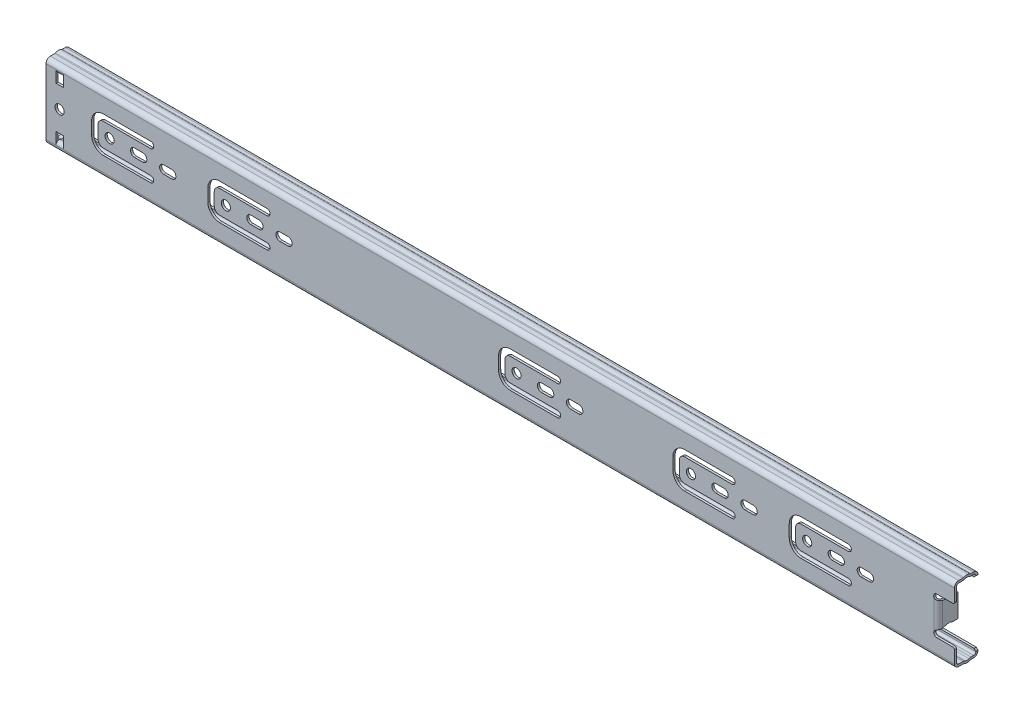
SolidWorks part; units mm, degrees
ref_plane "Front Plane" through (0, 0, 0) normal (0, 0, 1) x (1, 0, 0)
ref_plane "Top Plane" through (0, 0, 0) normal (0, 1, 0) x (1, 0, 0)
ref_plane "Right Plane" through (0, 0, 0) normal (1, 0, 0) x (0, 0, -1)
imported_body "Imported3"
sketch "Sketch1" plane through (237.9083, 0, 0) normal (-1, 0, 0) x (0, 0, 1)
  line L0 (-5.0493, 20.5) -> (0, 20.5)
  line L1 (0, 20.5) -> (0, -20.5)
  line L2 (0, -20.5) -> (-5.0493, -20.5)
  line L3 (-8.7641, -20.5) -> (-8.7641, -17.9939)
  line L4 (-8.7641, -17.9939) -> (-1.2, -17.9939)
  line L5 (-1.8294, -17.511) -> (-2.14, -16.3519)
  line L6 (-1.2, -16.3691) -> (-1.2, 16.3691)
  line L7 (-2.14, 16.3519) -> (-1.8294, 17.511)
  line L8 (-1.2, 17.9939) -> (-8.7641, 17.9939)
  line L9 (-8.7641, 17.9939) -> (-8.7641, 20.5)
  arc A0 (-8.7641, 20.5) -> (-5.0493, 20.5) centre (-6.9067, 17.3) cw
  arc A1 (-5.0493, -20.5) -> (-8.7641, -20.5) centre (-6.9067, -17.3) cw
  arc A2 (-1.2, -17.9939) -> (-1.8294, -17.511) centre (-1.7, -17.9939) ccw
  arc A3 (-2.14, -16.3519) -> (-1.2, -16.3691) centre (-1.7, -17.9939) cw
  arc A4 (-1.2, 16.3691) -> (-2.14, 16.3519) centre (-1.7, 17.9939) cw
  arc A5 (-1.8294, 17.511) -> (-1.2, 17.9939) centre (-1.7, 17.9939) ccw
extrude "Boss-Extrude1" add sketch "Sketch1" along normal blind 478.4083
sketch "Sketch2" plane through (237.9083, 0, 0) normal (1, 0, 0) x (0, 0, -1)
  line L0 (8.7641, 17.9939) -> (1.2, 17.9939)
  line L1 (1.8294, 17.511) -> (2.14, 16.3519)
  line L2 (1.2, 16.3691) -> (1.2, 10.4)
  line L3 (1.2, 10.4) -> (0, 10.4)
  line L4 (0, 10.4) -> (0, 20.5)
  line L5 (0, 20.5) -> (5.0493, 20.5)
  line L6 (8.7641, 20.5) -> (8.7641, 17.9939)
  arc A0 (1.2, 17.9939) -> (1.8294, 17.511) centre (1.7, 17.9939) ccw
  arc A1 (2.14, 16.3519) -> (1.2, 16.3691) centre (1.7, 17.9939) cw
  arc A2 (5.0493, 20.5) -> (8.7641, 20.5) centre (6.9067, 17.3) cw
extrude "Boss-Extrude2" add sketch "Sketch2" along normal blind 0.3762
sketch "Sketch3" plane through (-240.5, 0, 0) normal (-1, 0, 0) x (0, 0, 1)
  line L0 (-5.0493, 20.5) -> (0, 20.5)
  line L1 (0, 20.5) -> (0, -20.5)
  line L2 (0, -20.5) -> (-5.0493, -20.5)
  line L3 (-8.7641, -20.5) -> (-8.7641, -17.9939)
  line L4 (-8.7641, -17.9939) -> (-1.2, -17.9939)
  line L5 (-1.8294, -17.511) -> (-2.14, -16.3519)
  line L6 (-1.2, -16.3691) -> (-1.2, 16.3691)
  line L7 (-2.14, 16.3519) -> (-1.8294, 17.511)
  line L8 (-1.2, 17.9939) -> (-8.7641, 17.9939)
  line L9 (-8.7641, 17.9939) -> (-8.7641, 20.5)
  arc A0 (-8.7641, 20.5) -> (-5.0493, 20.5) centre (-6.9067, 17.3) cw
  arc A1 (-5.0493, -20.5) -> (-8.7641, -20.5) centre (-6.9067, -17.3) cw
  arc A2 (-1.2, -17.9939) -> (-1.8294, -17.511) centre (-1.7, -17.9939) ccw
  arc A3 (-2.14, -16.3519) -> (-1.2, -16.3691) centre (-1.7, -17.9939) cw
  arc A4 (-1.2, 16.3691) -> (-2.14, 16.3519) centre (-1.7, 17.9939) cw
  arc A5 (-1.8294, 17.511) -> (-1.2, 17.9939) centre (-1.7, 17.9939) ccw
extrude "Boss-Extrude3" add sketch "Sketch3" along normal blind 4
sketch "Sketch4" plane through (238.2845, 0, 0) normal (1, 0, 0) x (0, 0, -1)
  line L0 (8.7641, 17.9939) -> (1.2, 17.9939)
  line L1 (1.8294, 17.511) -> (2.14, 16.3519)
  line L2 (1.2, 16.3691) -> (1.2, 10.4)
  line L3 (1.2, 10.4) -> (0, 10.4)
  line L4 (0, 10.4) -> (0, 20.5)
  line L5 (0, 20.5) -> (5.0493, 20.5)
  line L6 (8.7641, 20.5) -> (8.7641, 17.9939)
  arc A0 (1.2, 17.9939) -> (1.8294, 17.511) centre (1.7, 17.9939) ccw
  arc A1 (2.14, 16.3519) -> (1.2, 16.3691) centre (1.7, 17.9939) cw
  arc A2 (5.0493, 20.5) -> (8.7641, 20.5) centre (6.9067, 17.3) cw
extrude "Boss-Extrude4" add sketch "Sketch4" along normal blind 1.5762
sketch "Sketch5" plane through (-244.5, 0, 0) normal (-1, 0, 0) x (0, 0, 1)
  line L0 (-5.0493, 20.5) -> (0, 20.5)
  line L1 (0, 20.5) -> (0, -20.5)
  line L2 (0, -20.5) -> (-5.0493, -20.5)
  line L3 (-8.7641, -20.5) -> (-8.7641, -17.9939)
  line L4 (-8.7641, -17.9939) -> (-1.2, -17.9939)
  line L5 (-1.8294, -17.511) -> (-2.14, -16.3519)
  line L6 (-1.2, -16.3691) -> (-1.2, 16.3691)
  line L7 (-2.14, 16.3519) -> (-1.8294, 17.511)
  line L8 (-1.2, 17.9939) -> (-8.7641, 17.9939)
  line L9 (-8.7641, 17.9939) -> (-8.7641, 20.5)
  arc A0 (-8.7641, 20.5) -> (-5.0493, 20.5) centre (-6.9067, 17.3) cw
  arc A1 (-5.0493, -20.5) -> (-8.7641, -20.5) centre (-6.9067, -17.3) cw
  arc A2 (-1.2, -17.9939) -> (-1.8294, -17.511) centre (-1.7, -17.9939) ccw
  arc A3 (-2.14, -16.3519) -> (-1.2, -16.3691) centre (-1.7, -17.9939) cw
  arc A4 (-1.2, 16.3691) -> (-2.14, 16.3519) centre (-1.7, 17.9939) cw
  arc A5 (-1.8294, 17.511) -> (-1.2, 17.9939) centre (-1.7, 17.9939) ccw
extrude "Boss-Extrude5" add sketch "Sketch5" along normal blind 5.5
sketch "Sketch6" plane through (239.8607, 0, 0) normal (1, 0, 0) x (0, 0, -1)
  line L0 (8.7641, 17.9939) -> (1.2, 17.9939)
  line L1 (1.8294, 17.511) -> (2.14, 16.3519)
  line L2 (1.2, 16.3691) -> (1.2, 10.4)
  line L3 (1.2, 10.4) -> (0, 10.4)
  line L4 (0, 10.4) -> (0, 20.5)
  line L5 (0, 20.5) -> (5.0493, 20.5)
  line L6 (8.7641, 20.5) -> (8.7641, 17.9939)
  arc A0 (1.2, 17.9939) -> (1.8294, 17.511) centre (1.7, 17.9939) ccw
  arc A1 (2.14, 16.3519) -> (1.2, 16.3691) centre (1.7, 17.9939) cw
  arc A2 (5.0493, 20.5) -> (8.7641, 20.5) centre (6.9067, 17.3) cw
extrude "Boss-Extrude6" add sketch "Sketch6" along normal blind 10.1393
sketch "Sketch7" plane through (250, 0, 0) normal (1, 0, 0) x (0, 0, -1)
  line L0 (2.14, 16.3519) -> (1.8294, 17.511)
  line L1 (1.2, 17.9939) -> (1.2, 16.3691)
  arc A0 (1.2, 16.3691) -> (2.14, 16.3519) centre (1.7, 17.9939) ccw
  arc A1 (1.8294, 17.511) -> (1.2, 17.9939) centre (1.7, 17.9939) cw
extrude "Cut-Extrude1" cut sketch "Sketch7" against normal blind 490.5
sketch "Sketch8" plane through (-250, 0, 0) normal (-1, 0, 0) x (0, 0, 1)
  line L0 (-1.8294, 17.511) -> (-2.14, 16.3519)
  line L1 (-1.2, 16.3691) -> (-1.2, 17.9939)
  arc A0 (-2.14, 16.3519) -> (-1.2, 16.3691) centre (-1.7, 17.9939) ccw
  arc A1 (-1.2, 17.9939) -> (-1.8294, 17.511) centre (-1.7, 17.9939) cw
extrude "Cut-Extrude2" cut sketch "Sketch8" against normal blind 5.5
sketch "Sketch9" plane through (0, 17.9939, 0) normal (0, -1, 0) x (1, 0, 0)
  line L0 (-250, -1.2) -> (-250, -8.7641)
  line L1 (-250, -8.7641) -> (250, -8.7641)
  line L2 (250, -8.7641) -> (250, -1.2)
  line L3 (250, -1.2) -> (-250, -1.2)
extrude "Cut-Extrude3" cut sketch "Sketch9" against normal blind 1.3061
sketch "Sketch10" plane through (-250, 0, 0) normal (-1, 0, 0) x (0, 0, 1)
  line L0 (-2.14, -16.3519) -> (-1.8294, -17.511)
  line L1 (-1.2, -17.9939) -> (-1.2, -16.3691)
  arc A0 (-1.2, -16.3691) -> (-2.14, -16.3519) centre (-1.7, -17.9939) ccw
  arc A1 (-1.8294, -17.511) -> (-1.2, -17.9939) centre (-1.7, -17.9939) cw
extrude "Cut-Extrude4" cut sketch "Sketch10" against normal blind 5.5
ref_plane "Plane1" through (-244.5, 0, 0) normal (-1, 0, 0) x (0, -1, 0)
sketch "Sketch11" plane through (-244.5, 0, 0) normal (-1, 0, 0) x (0, -1, 0)
  line L0 (-16.3691, -1.2) -> (-11.5, -1.2)
  line L1 (-11.5, -1.2) -> (-11.5, 0)
  line L2 (-11.5, 0) -> (-17.9939, 0)
  arc A0 (-17.9939, 0) -> (-16.3691, -1.2) centre (-17.9939, -1.7) cw
extrude "Cut-Extrude5" cut sketch "Sketch11" against normal blind 4
ref_plane "Plane2" through (-240.5, 0, 0) normal (1, 0, 0) x (0, 0, -1)
sketch "Sketch12" plane through (-240.5, 0, 0) normal (1, 0, 0) x (0, 0, -1)
  line L0 (1.2, -16.3691) -> (1.2, -11.5)
  line L1 (1.2, -11.5) -> (0, -11.5)
  line L2 (0, -11.5) -> (0, -17.9939)
  arc A0 (0, -17.9939) -> (1.2, -16.3691) centre (1.7, -17.9939) cw
extrude "Cut-Extrude6" cut sketch "Sketch12" against normal blind 4
sketch "Sketch13" plane through (0, 0, -8.7641) normal (0, 0, -1) x (-1, 0, 0)
  line L0 (-250, 19.3) -> (-250, 20.5)
  line L1 (-250, 20.5) -> (250, 20.5)
  line L2 (250, 20.5) -> (250, 19.3)
  line L3 (250, 19.3) -> (-250, 19.3)
extrude "Boss-Extrude7" add sketch "Sketch13" along normal blind 4.2359
sketch "Sketch14" plane through (0, 0, -8.7641) normal (0, 0, -1) x (-1, 0, 0)
  line L0 (250, -17.9939) -> (250, -20.5)
  line L1 (250, -20.5) -> (-240.3788, -20.5)
  line L2 (-240.3788, -20.5) -> (-240.3788, -17.9939)
  line L3 (-240.3788, -17.9939) -> (250, -17.9939)
extrude "Boss-Extrude8" add sketch "Sketch14" along normal blind 4.2359
sketch "Sketch15" plane through (240.3788, 0, 0) normal (1, 0, 0) x (0, 0, -1)
  line L0 (1.8294, -17.511) -> (2.14, -16.3519)
  line L1 (1.2, -16.3691) -> (1.2, -17.9939)
  arc A0 (2.14, -16.3519) -> (1.2, -16.3691) centre (1.7, -17.9939) ccw
  arc A1 (1.2, -17.9939) -> (1.8294, -17.511) centre (1.7, -17.9939) cw
extrude "Cut-Extrude7" cut sketch "Sketch15" against normal blind 480.8788
sketch "Sketch16" plane through (0, -17.9939, 0) normal (0, 1, 0) x (-1, 0, 0)
  line L0 (-240.3788, -1.2) -> (-240.3788, -13)
  line L1 (-240.3788, -13) -> (250, -13)
  line L2 (250, -13) -> (250, -1.2)
  line L3 (250, -1.2) -> (-240.3788, -1.2)
extrude "Cut-Extrude8" cut sketch "Sketch16" against normal blind 1.3061
sketch "Sketch17" plane through (0, -1.6304, -6.0846) normal (0, -0.2588, -0.9659) x (-1, 0, 0)
  line L0 (240.5, -15.2408) -> (244.5, -15.2408)
  line L1 (244.5, -15.2408) -> (244.5, -16.4408)
  line L2 (244.5, -16.4408) -> (240.5, -16.4408)
  line L3 (240.5, -16.4408) -> (240.5, -15.2408)
extrude "Boss-Extrude9" add sketch "Sketch17" along normal blind 3.7845
sketch "Sketch18" plane through (0, 19.3, 0) normal (0, -1, 0) x (1, 0, 0)
  line L0 (250, -13) -> (-250, -13)
  line L1 (-250, -13) -> (-250, -11.8)
  line L2 (-250, -11.8) -> (250, -11.8)
  line L3 (250, -11.8) -> (250, -13)
extrude "Boss-Extrude10" add sketch "Sketch18" along normal blind 2.3
sketch "Sketch19" plane through (0, -19.3, 0) normal (0, 1, 0) x (-1, 0, 0)
  line L0 (-240.3788, -11.8) -> (250, -11.8)
  line L1 (250, -11.8) -> (250, -13)
  line L2 (250, -13) -> (-240.3788, -13)
  line L3 (-240.3788, -13) -> (-240.3788, -11.8)
extrude "Boss-Extrude11" add sketch "Sketch19" along normal blind 2.3
sketch "Sketch20" plane through (0, 1.6304, -6.0846) normal (0, 0.2588, -0.9659) x (-1, 0, 0)
  line L0 (244.5, 15.2408) -> (240.5, 15.2408)
  line L1 (240.5, 15.2408) -> (240.5, 16.4408)
  line L2 (240.5, 16.4408) -> (244.5, 16.4408)
  line L3 (244.5, 16.4408) -> (244.5, 15.2408)
extrude "Boss-Extrude12" add sketch "Sketch20" along normal blind 3.7845
sketch "Sketch21" plane through (240.3788, 0, 0) normal (1, 0, 0) x (0, 0, -1)
  line L0 (1.2, -10.4) -> (1.2, -19.3)
  line L1 (1.2, -19.3) -> (11.8, -19.3)
  line L2 (11.8, -19.3) -> (11.8, -17)
  line L3 (11.8, -17) -> (13, -17)
  line L4 (13, -17) -> (13, -20.5)
  line L5 (13, -20.5) -> (8.7641, -20.5)
  line L6 (5.0493, -20.5) -> (0, -20.5)
  line L7 (0, -20.5) -> (0, -10.4)
  line L8 (0, -10.4) -> (1.2, -10.4)
  arc A0 (8.7641, -20.5) -> (5.0493, -20.5) centre (6.9067, -17.3) cw
extrude "Boss-Extrude13" add sketch "Sketch21" along normal blind 9.6212
sketch "Sketch22" plane through (-250, 0, 0) normal (-1, 0, 0) x (0, 0, 1)
  line L0 (-8.4067, 19.3) -> (-5.4067, 19.3)
  arc A0 (-5.4067, 19.3) -> (-8.4067, 19.3) centre (-6.9067, 17.3) ccw
extrude "Cut-Extrude9" cut sketch "Sketch22" against normal through all
sketch "Sketch23" plane through (250, 0, 0) normal (1, 0, 0) x (0, 0, -1)
  line L0 (8.4067, -19.3) -> (5.4067, -19.3)
  arc A0 (5.4067, -19.3) -> (8.4067, -19.3) centre (6.9067, -17.3) ccw
extrude "Cut-Extrude10" cut sketch "Sketch23" against normal through all
sketch "Sketch24" plane through (0, 0, -1.2) normal (0, 0, -1) x (-1, 0, 0)
  line L0 (201.25, 2.25) -> (196.75, 2.25)
  line L1 (196.75, -2.25) -> (201.25, -2.25)
  arc A0 (201.25, -2.25) -> (201.25, 2.25) centre (201.25, 0) ccw
  arc A1 (196.75, 2.25) -> (196.75, -2.25) centre (196.75, 0) ccw
extrude "Cut-Extrude11" cut sketch "Sketch24" against normal through all
sketch "Sketch25" plane through (0, 0, -1.2) normal (0, 0, -1) x (-1, 0, 0)
  line L0 (185.25, 2.25) -> (180.75, 2.25)
  line L1 (180.75, -2.25) -> (185.25, -2.25)
  arc A0 (185.25, -2.25) -> (185.25, 2.25) centre (185.25, 0) ccw
  arc A1 (180.75, 2.25) -> (180.75, -2.25) centre (180.75, 0) ccw
extrude "Cut-Extrude12" cut sketch "Sketch25" against normal through all
sketch "Sketch26" plane through (0, 0, -1.2) normal (0, 0, -1) x (-1, 0, 0)
  line L0 (224.9, 9.9) -> (192.45, 9.9)
  line L1 (192.45, 6.4) -> (221.4, 6.4)
  line L2 (221.4, 6.4) -> (221.4, -6.4)
  line L3 (221.4, -6.4) -> (192.45, -6.4)
  line L4 (192.45, -9.9) -> (224.9, -9.9)
  line L5 (224.9, -9.9) -> (224.9, 9.9)
  arc A0 (192.45, 9.9) -> (192.45, 6.4) centre (192.45, 8.15) ccw
  arc A1 (192.45, -6.4) -> (192.45, -9.9) centre (192.45, -8.15) ccw
extrude "Cut-Extrude13" cut sketch "Sketch26" against normal through all
sketch "Sketch27" plane through (0, 0, -1.2) normal (0, 0, -1) x (-1, 0, 0)
  line L0 (-159.1, 9.9) -> (-191.55, 9.9)
  line L1 (-191.55, 6.4) -> (-162.6, 6.4)
  line L2 (-162.6, 6.4) -> (-162.6, -6.4)
  line L3 (-162.6, -6.4) -> (-191.55, -6.4)
  line L4 (-191.55, -9.9) -> (-159.1, -9.9)
  line L5 (-159.1, -9.9) -> (-159.1, 9.9)
  arc A0 (-191.55, 9.9) -> (-191.55, 6.4) centre (-191.55, 8.15) ccw
  arc A1 (-191.55, -6.4) -> (-191.55, -9.9) centre (-191.55, -8.15) ccw
extrude "Cut-Extrude14" cut sketch "Sketch27" against normal through all
sketch "Sketch28" plane through (0, 0, -1.2) normal (0, 0, -1) x (-1, 0, 0)
  line L0 (-95.1, 9.9) -> (-127.55, 9.9)
  line L1 (-127.55, 6.4) -> (-98.6, 6.4)
  line L2 (-98.6, 6.4) -> (-98.6, -6.4)
  line L3 (-98.6, -6.4) -> (-127.55, -6.4)
  line L4 (-127.55, -9.9) -> (-95.1, -9.9)
  line L5 (-95.1, -9.9) -> (-95.1, 9.9)
  arc A0 (-127.55, 9.9) -> (-127.55, 6.4) centre (-127.55, 8.15) ccw
  arc A1 (-127.55, -6.4) -> (-127.55, -9.9) centre (-127.55, -8.15) ccw
extrude "Cut-Extrude15" cut sketch "Sketch28" against normal through all
sketch "Sketch29" plane through (0, 0, -1.2) normal (0, 0, -1) x (-1, 0, 0)
  line L0 (0.9, 9.9) -> (-31.55, 9.9)
  line L1 (-31.55, 6.4) -> (-2.6, 6.4)
  line L2 (-2.6, 6.4) -> (-2.6, -6.4)
  line L3 (-2.6, -6.4) -> (-31.55, -6.4)
  line L4 (-31.55, -9.9) -> (0.9, -9.9)
  line L5 (0.9, -9.9) -> (0.9, 9.9)
  arc A0 (-31.55, 9.9) -> (-31.55, 6.4) centre (-31.55, 8.15) ccw
  arc A1 (-31.55, -6.4) -> (-31.55, -9.9) centre (-31.55, -8.15) ccw
extrude "Cut-Extrude16" cut sketch "Sketch29" against normal through all
sketch "Sketch30" plane through (0, 0, -1.2) normal (0, 0, -1) x (-1, 0, 0)
  line L0 (160.9, 9.9) -> (128.45, 9.9)
  line L1 (128.45, 6.4) -> (157.4, 6.4)
  line L2 (157.4, 6.4) -> (157.4, -6.4)
  line L3 (157.4, -6.4) -> (128.45, -6.4)
  line L4 (128.45, -9.9) -> (160.9, -9.9)
  line L5 (160.9, -9.9) -> (160.9, 9.9)
  arc A0 (128.45, 9.9) -> (128.45, 6.4) centre (128.45, 8.15) ccw
  arc A1 (128.45, -6.4) -> (128.45, -9.9) centre (128.45, -8.15) ccw
extrude "Cut-Extrude17" cut sketch "Sketch30" against normal through all
sketch "Sketch31" plane through (0, 0, -1.2) normal (0, 0, -1) x (-1, 0, 0)
  line L0 (-182.75, 2.25) -> (-187.25, 2.25)
  line L1 (-187.25, -2.25) -> (-182.75, -2.25)
  arc A0 (-182.75, -2.25) -> (-182.75, 2.25) centre (-182.75, 0) ccw
  arc A1 (-187.25, 2.25) -> (-187.25, -2.25) centre (-187.25, 0) ccw
extrude "Cut-Extrude18" cut sketch "Sketch31" against normal through all
sketch "Sketch32" plane through (0, 0, -1.2) normal (0, 0, -1) x (-1, 0, 0)
  line L0 (-118.75, 2.25) -> (-123.25, 2.25)
  line L1 (-123.25, -2.25) -> (-118.75, -2.25)
  arc A0 (-118.75, -2.25) -> (-118.75, 2.25) centre (-118.75, 0) ccw
  arc A1 (-123.25, 2.25) -> (-123.25, -2.25) centre (-123.25, 0) ccw
extrude "Cut-Extrude19" cut sketch "Sketch32" against normal through all
sketch "Sketch33" plane through (0, 0, -1.2) normal (0, 0, -1) x (-1, 0, 0)
  line L0 (-22.75, 2.25) -> (-27.25, 2.25)
  line L1 (-27.25, -2.25) -> (-22.75, -2.25)
  arc A0 (-22.75, -2.25) -> (-22.75, 2.25) centre (-22.75, 0) ccw
  arc A1 (-27.25, 2.25) -> (-27.25, -2.25) centre (-27.25, 0) ccw
extrude "Cut-Extrude20" cut sketch "Sketch33" against normal through all
sketch "Sketch34" plane through (0, 0, -1.2) normal (0, 0, -1) x (-1, 0, 0)
  line L0 (137.25, 2.25) -> (132.75, 2.25)
  line L1 (132.75, -2.25) -> (137.25, -2.25)
  arc A0 (137.25, -2.25) -> (137.25, 2.25) centre (137.25, 0) ccw
  arc A1 (132.75, 2.25) -> (132.75, -2.25) centre (132.75, 0) ccw
extrude "Cut-Extrude21" cut sketch "Sketch34" against normal through all
sketch "Sketch35" plane through (0, 0, -1.2) normal (0, 0, -1) x (-1, 0, 0)
  line L0 (-198.75, 2.25) -> (-203.25, 2.25)
  line L1 (-203.25, -2.25) -> (-198.75, -2.25)
  arc A0 (-198.75, -2.25) -> (-198.75, 2.25) centre (-198.75, 0) ccw
  arc A1 (-203.25, 2.25) -> (-203.25, -2.25) centre (-203.25, 0) ccw
extrude "Cut-Extrude22" cut sketch "Sketch35" against normal through all
sketch "Sketch36" plane through (0, 0, -1.2) normal (0, 0, -1) x (-1, 0, 0)
  line L0 (-134.75, 2.25) -> (-139.25, 2.25)
  line L1 (-139.25, -2.25) -> (-134.75, -2.25)
  arc A0 (-134.75, -2.25) -> (-134.75, 2.25) centre (-134.75, 0) ccw
  arc A1 (-139.25, 2.25) -> (-139.25, -2.25) centre (-139.25, 0) ccw
extrude "Cut-Extrude23" cut sketch "Sketch36" against normal through all
sketch "Sketch37" plane through (0, 0, -1.2) normal (0, 0, -1) x (-1, 0, 0)
  line L0 (-38.75, 2.25) -> (-43.25, 2.25)
  line L1 (-43.25, -2.25) -> (-38.75, -2.25)
  arc A0 (-38.75, -2.25) -> (-38.75, 2.25) centre (-38.75, 0) ccw
  arc A1 (-43.25, 2.25) -> (-43.25, -2.25) centre (-43.25, 0) ccw
extrude "Cut-Extrude24" cut sketch "Sketch37" against normal through all
sketch "Sketch38" plane through (0, 0, 0) normal (0, 0, 1) x (1, 0, 0)
  line L0 (-121.25, -2.25) -> (-116.75, -2.25)
  line L1 (-116.75, 2.25) -> (-121.25, 2.25)
  arc A0 (-121.25, 2.25) -> (-121.25, -2.25) centre (-121.25, 0) ccw
  arc A1 (-116.75, -2.25) -> (-116.75, 2.25) centre (-116.75, 0) ccw
extrude "Cut-Extrude25" cut sketch "Sketch38" against normal up to next
hole_wizard "Ø5.0 (5) Diameter Hole1" positions "Sketch40" profile "Sketch39" hole size "Ø5.0" standard "ANSI Metric"
sketch "Sketch40" plane through (0, 0, -1.2) normal (0, 0, -1) x (-1, 0, 0)
  point P0 (151, 0)
  point P1 (-9, 0)
  point P2 (-105, 0)
  point P3 (-169, 0)
  point P4 (215, 0)
  point P5 (242.5, 0)
sketch "Sketch39" plane through (-151, 0, -1.2) normal (1, 0, 0) x (0, 1, 0)
  line L0 (0, 0) -> (0, 2.2073)
  line L1 (0, 2.2073) -> (2.5, 2.2073)
  line L2 (2.5, 2.2073) -> (2.5, 0)
  line L5 (2.5, 0) -> (0, 0)
  line L11 (0, -6.35) -> (0, 107.95) construction
  dimension "Thru Hole Dia." = 5
  dimension "Thru Hole Depth" = 2.2073
chamfer "Chamfer1" distance 1 angle 45 4 edges at (-250, 17, -12.4) (250, 17, -12.4) (-250, -17, -12.4) (250, -17, -12.4)
fillet "Fillet1" radius 0.0912 2 edges at (240.4607, 6.4, -7.5873) (240.4607, -6.4, -7.5873)
fillet "Fillet2" radius 0.5 2 edges at (240.4607, 6.4, -11.0607) (240.4607, -6.4, -11.0607)
fillet "Fillet3" radius 1 2 edges at (250, -10.4, -0.6) (250, 10.4, -0.6)
fillet "Fillet4" radius 1.2 13 edges at (0, -20.5, -5.0493) (0, -20.5, -8.7641) (0, 20.5, -5.0493) (0, 20.5, -8.7641) (0, 19.3, -1.2) (0, -19.3, -1.2) (0, 19.3, -11.8) (0, -19.3, -11.8) (238.8008, 7.7847, -1.2) (239.0043, -7.467, -1.2) (239.8607, -6.7851, -1.9323) (239.8607, 6.7851, -1.9323) (239.8607, 0, -1.2)
fillet "Fillet7" radius 1.6 1 edges
fillet "Fillet8" radius 2.4 9 edges at (0, 20.5, 0) (0, -19.3, -8.4067) (0, -19.3, -5.4067) (0, 19.3, -8.4067) (0, 19.3, -5.4067) (0, 20.5, -13) (241.0607, 0, 0) (0, -20.5, 0) (0, -20.5, -13)
fillet "Fillet9" radius 3 10 edges at (-221.4, 6.4, -0.6) (-157.4, -6.4, -0.6) (162.6, -6.4, -0.6) (-157.4, 6.4, -0.6) (162.6, 6.4, -0.6) (98.6, 6.4, -0.6) (98.6, -6.4, -0.6) (2.6, 6.4, -0.6) (2.6, -6.4, -0.6) (-221.4, -6.4, -0.6)
fillet "Fillet10" radius 6.5 10 edges at (95.1, 9.9, -0.6) (-224.9, 9.9, -0.6) (159.1, 9.9, -0.6) (-160.9, -9.9, -0.6) (95.1, -9.9, -0.6) (-160.9, 9.9, -0.6) (159.1, -9.9, -0.6) (-0.9, -9.9, -0.6) (-0.9, 9.9, -0.6) (-224.9, -9.9, -0.6)
